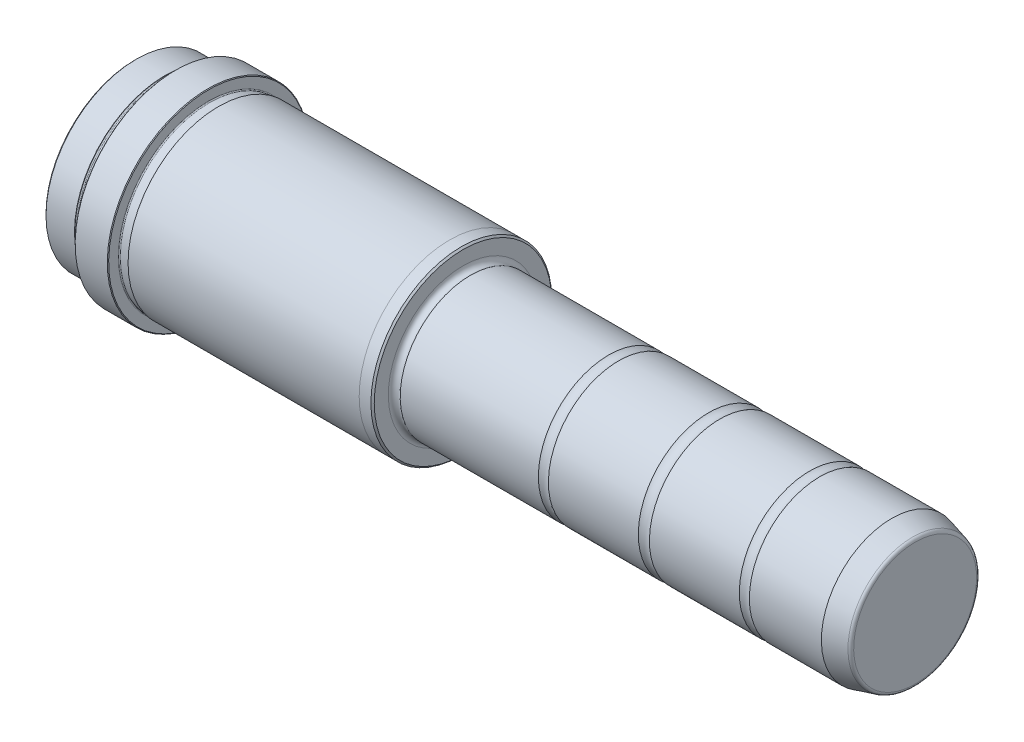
SolidWorks part; units mm, degrees
ref_plane "Front Plane" through (0, 0, 0) normal (0, 0, 1) x (1, 0, 0)
ref_plane "Top Plane" through (0, 0, 0) normal (0, 1, 0) x (1, 0, 0)
ref_plane "Right Plane" through (0, 0, 0) normal (1, 0, 0) x (0, 0, -1)
sketch "Sketch1" plane through (0, 0, 0) normal (0, 0, 1) x (1, 0, 0)
  line L0 (135, 19.1244) -> (128, 21)
  line L1 (128, 21) -> (2.2483, 21)
  line L2 (0, 22.3) -> (0, 27)
  line L3 (0, 27) -> (-4, 27)
  line L4 (-73, 27.0001) -> (-73, 26.9)
  line L5 (-73.3, 26.6) -> (-75.7, 26.6)
  line L6 (-76, 26.9) -> (-76, 30)
  line L7 (-76, 30) -> (-86, 30)
  line L8 (-86, 30) -> (-86, 26.9)
  line L9 (-86.3, 26.6) -> (-88.7, 26.6)
  line L10 (-89, 26.9) -> (-89, 27)
  line L11 (-89, 27) -> (-98, 27)
  line L12 (-98, 27) -> (-98, 0)
  line L13 (135, 19.1244) -> (135, 0)
  line L14 (135, 0) -> (-135, 0) construction
  line L15 (135, 0) -> (-98, 0)
  line L16 (-4, 27.0001) -> (-73, 27.0001)
  line L17 (-4, 27.0001) -> (-4, 27)
  arc A0 (0, 22.3) -> (2.2483, 21) centre (1.5, 22.3) ccw
  arc A1 (-86, 26.9) -> (-86.3, 26.6) centre (-86.3, 26.9) cw
  arc A2 (-88.7, 26.6) -> (-89, 26.9) centre (-88.7, 26.9) cw
  arc A3 (-75.7, 26.6) -> (-76, 26.9) centre (-75.7, 26.9) cw
  arc A4 (-73, 26.9) -> (-73.3, 26.6) centre (-73.3, 26.9) cw
  point P16 (0, 0)
  point P28 (-76, 26.6)
  point P31 (-73, 26.6)
  dimension "ShoulderRadii" = 3
  dimension "D5" = 0.3
  dimension "D1" = 15
  dimension "D2" = 0.4
  dimension "PinDia" = 42
  dimension "ChamferLeadIn" = 7
  dimension "ShoulderDia" = 54
  dimension "PinLengthN" = 135
  dimension "ShoulderLength" = 86
  dimension "D3" = 0.0001
  dimension "ShoulderGap" = 3
  dimension "D4" = 4
  dimension "T" = 10
  dimension "CollarLength" = 12
  dimension "HeadDia" = 60
  dimension "D8" = 0.2
revolve "Revolve1" add sketch "Sketch1" angle 360 about L14
sketch "Sketch2" plane through (0, 0, 0) normal (0, 0, 1) x (1, 0, 0)
  line L0 (135, -19.1244) -> (135, 19.1244) construction
  line L1 (145.9417, 20.6) -> (148.0583, 20.6) construction
  line L2 (128, 21) -> (2.2483, 21) construction
  line L4 (103.5033, 21) -> (106.4967, 21)
  arc A0 (103.5033, 21) -> (106.4967, 21) centre (105, 23.6) ccw
  dimension "GrooveRadius" = 3
  dimension "D3" = 0.4
  dimension "AGroove" = 30
revolve "Groove A" cut sketch "Sketch2" angle 360 about axis through (135, 0, 0) along (1, 0, 0)
sketch "Sketch3" plane through (0, 0, 0) normal (0, 0, 1) x (1, 0, 0)
  line L0 (103.5033, 21) -> (2.2483, 21) construction
  line L3 (73.3417, 21) -> (76.6583, 21)
  arc A0 (73.3417, 21) -> (76.6583, 21) centre (75, 23.5) ccw
  arc A1 (103.5033, 21) -> (106.4967, 21) centre (105, 23.6) ccw construction
  dimension "D1" = 0.5
  dimension "GroovePitch" = 30
revolve "Groove B" cut sketch "Sketch3" angle 360 about axis through (135, 0, 0) along (1, 0, 0)
sketch "Sketch4" plane through (0, 0, 0) normal (0, 0, 1) x (1, 0, 0)
  line L2 (73.3417, 21) -> (2.2483, 21) construction
  line L3 (43.5033, 21) -> (46.4967, 21)
  arc A0 (43.5033, 21) -> (46.4967, 21) centre (45, 23.6) ccw
  arc A3 (73.3417, 21) -> (76.6583, 21) centre (75, 23.5) ccw construction
  dimension "D1" = 0.4
revolve "Groove C" cut sketch "Sketch4" angle 360 about axis through (135, 0, 0) along (1, 0, 0)
sketch "Sketch5" plane through (0, 0, 0) normal (0, 0, 1) x (1, 0, 0)
  line L0 (13.5033, 21) -> (16.4967, 21)
  line L1 (43.5033, 21) -> (2.2483, 21) construction
  arc A0 (13.5033, 21) -> (16.4967, 21) centre (15, 23.6) ccw
  arc A3 (43.5033, 21) -> (46.4967, 21) centre (45, 23.6) ccw construction
  dimension "D1" = 0.4
revolve "Groove D" [suppressed] cut sketch "Sketch5" angle 360
fillet "Fillet1" radius 1 1 edges at (135, 19.1244, 0)
chamfer "Chamfer1" distance 0.2 angle 45 2 edges at (-86, 30, 0) (-76, 30, 0)
chamfer "Chamfer2" distance 0.5 angle 45 2 edges at (-98, 27, 0) (0, 27, 0)
